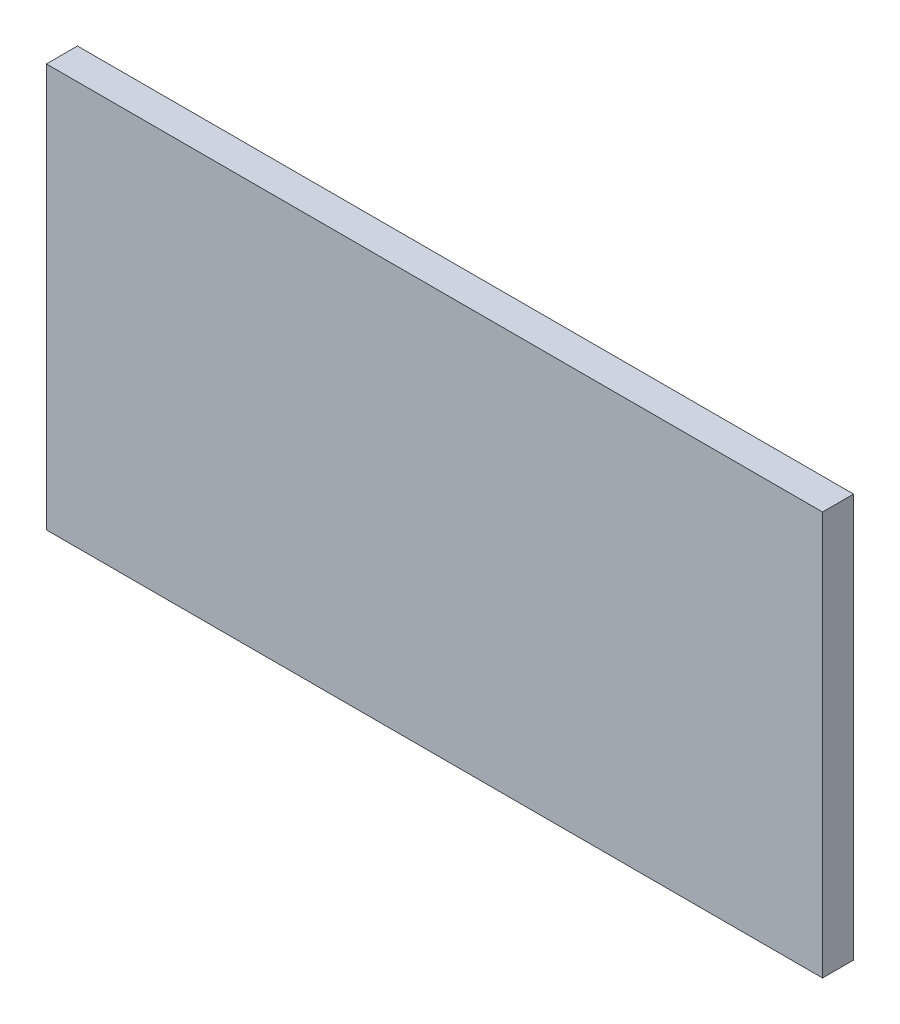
SolidWorks part; units mm, degrees
ref_plane "Front Plane" through (0, 0, 0) normal (0, 0, 1) x (1, 0, 0)
ref_plane "Top Plane" through (0, 0, 0) normal (0, 1, 0) x (1, 0, 0)
ref_plane "Right Plane" through (0, 0, 0) normal (1, 0, 0) x (0, 0, -1)
sketch "Sketch1" plane through (0, 0, 0) normal (0, 0, 1) x (1, 0, 0)
  line L1 (0, 0) -> (2540, 0)
  line L2 (0, 0) -> (0, 1320.8)
  line L3 (0, 1320.8) -> (2540, 1320.8)
  line L4 (2540, 0) -> (2540, 1320.8)
  dimension "D1" = 2540
  dimension "D2" = 1320.8
extrude "Boss-Extrude1" add sketch "Sketch1" along normal blind 101.6
